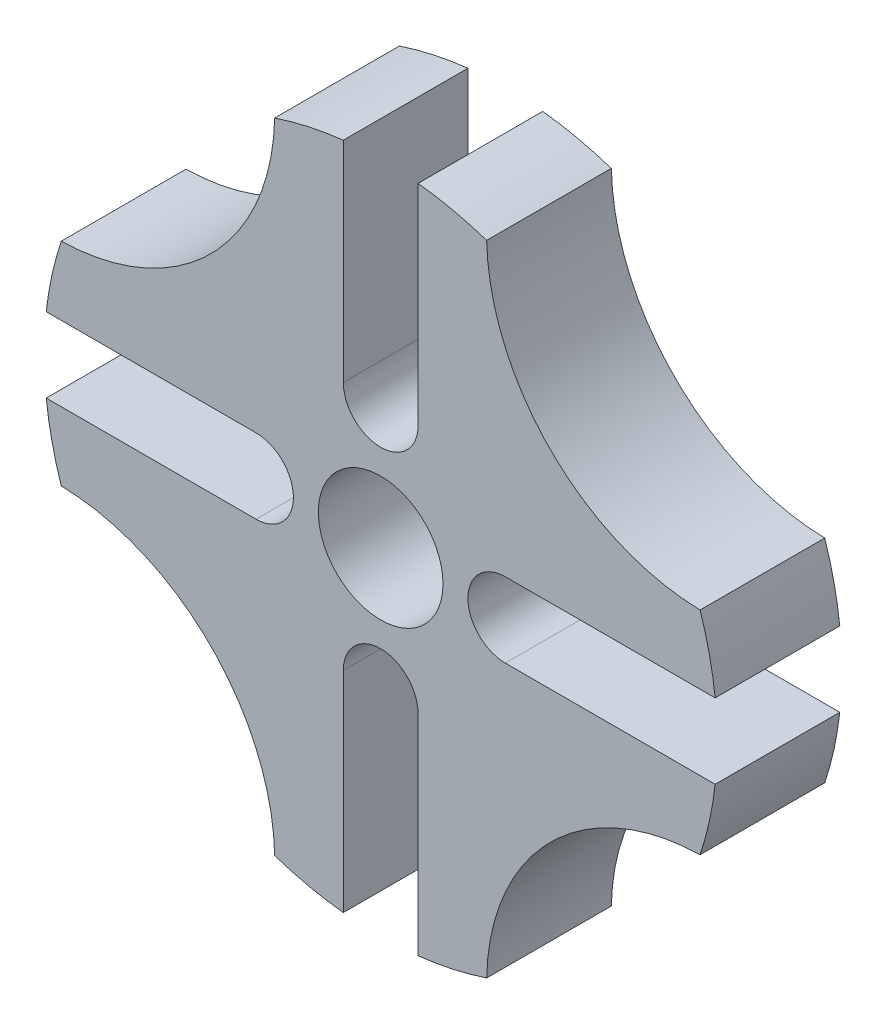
SolidWorks part; units mm, degrees
ref_plane "Plan de face" through (0, 0, 0) normal (0, 0, 1) x (1, 0, 0)
ref_plane "Plan de dessus" through (0, 0, 0) normal (0, 1, 0) x (1, 0, 0)
ref_plane "Plan de droite" through (0, 0, 0) normal (1, 0, 0) x (0, 0, -1)
sketch "Esquisse1" plane through (0, 0, 0) normal (0, 0, 1) x (1, 0, 0)
  line L0 (-13.2341, 0) -> (26.9494, 0) construction
  line L1 (10, 0) -> (10, 15.9954) construction
  circle A0 centre (0, 0) radius 27
  circle A1 centre (0, 0) radius 10 construction
  circle A2 centre (0, 0) radius 5
  dimension "D1" = 54
  dimension "D2" = 20
  dimension "D3" = 10
extrude "Extrusion1" add sketch "Esquisse1" along normal blind 10
sketch "Esquisse2" plane through (0, 0, 10) normal (0, 0, 1) x (1, 0, 0)
  line L0 (10, 3) -> (26.8328, 3)
  line L1 (10, 0) -> (10, 15.9954) construction
  line L2 (10, -3) -> (26.8328, -3)
  line L5 (0, 0) -> (37.1067, 0) construction
  arc A0 (10, 3) -> (10, -3) centre (10, 0) ccw
  circle A1 centre (0, 0) radius 27 construction
  arc A2 (26.8328, -3) -> (26.8328, 3) centre (0, 0) ccw
  dimension "D1" = 3
extrude "Enlèv. mat.-Extru.1" cut sketch "Esquisse2" against normal through all
pattern_circular "Répétition circulaire1" count 4 every 90 about axis through (0, 0, 0) along (0, 0, 1) of "Enlèv. mat.-Extru.1"
sketch "Esquisse3" plane through (0, 0, 10) normal (0, 0, 1) x (1, 0, 0)
  arc A0 (8.504, 25.6258) -> (25.6258, 8.504) centre (26, 26) ccw
  arc A1 (26.8328, 3) -> (3, 26.8328) centre (0, 0) ccw construction
  arc A2 (25.6258, 8.504) -> (8.504, 25.6258) centre (0, 0) ccw
  dimension "D3" = 35
  dimension "D1" = 26
  dimension "D2" = 26
extrude "Enlèv. mat.-Extru.2" cut sketch "Esquisse3" against normal through all
pattern_circular "Répétition circulaire2" count 4 every 90 about axis through (0, 0, 0) along (0, 0, 1) of "Enlèv. mat.-Extru.2"
